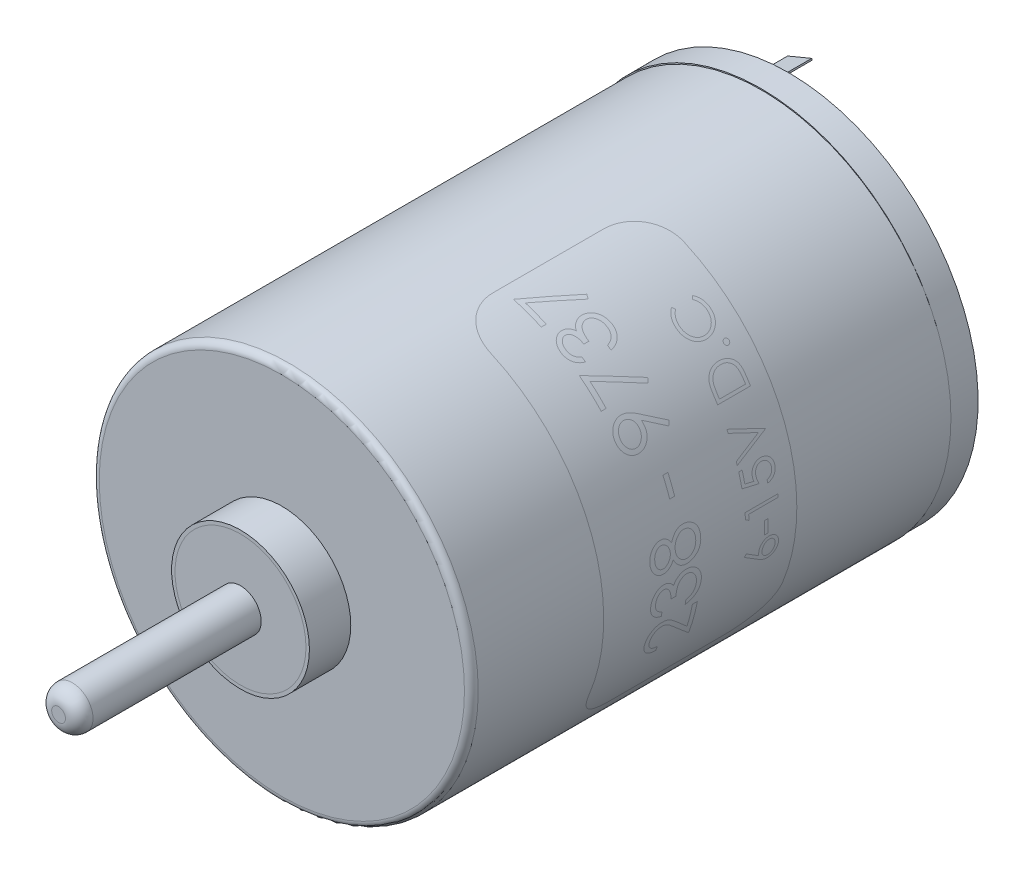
SolidWorks part; units mm, degrees
ref_plane "Front Plane" through (0, 0, 0) normal (0, 0, 1) x (1, 0, 0)
ref_plane "Top Plane" through (0, 0, 0) normal (0, 1, 0) x (1, 0, 0)
ref_plane "Right Plane" through (0, 0, 0) normal (1, 0, 0) x (0, 0, -1)
imported_body "Casing-1-solid1"
imported_body "Endplate-1-solid1"
imported_body "Endplate-1-solid2"
imported_body "Endplate-1-solid3"
imported_body "Rotorshaft-1-solid1"
imported_body "Bearing-1-solid1"
ref_plane "Plane1" through (7.7753, 3.2242, 0) normal (0.9237, 0.383, 0) x (0, 0, -1)
sketch "Sketch1" plane through (7.7753, 3.2242, 0) normal (0.9237, 0.383, 0) x (0, 0, -1)
  line L0 (-1.1844, 17.5157) -> (-1.1844, -8.0143) construction
  line L5 (4.4889, 17.5157) -> (4.4889, -7.7179) construction
  text T0 " 238 - 9737"
  text T1 "6-15V D.C" font "Century Gothic" height in points 9
wrap "Wrap1" sketch "Sketch1" wrap type scribe source sketch "Sketch1"
sketch "Sketch2" plane through (7.7753, 3.2242, 0) normal (0.9237, 0.383, 0) x (0, 0, -1)
  line L0 (-17.3244, -8.9015) -> (16.9756, -8.9015) construction
  line L1 (-5.2202, 18.291) -> (2.7921, 18.291)
  line L2 (-8.2202, 15.291) -> (-8.2202, -5.9015)
  line L3 (-5.2202, -8.9015) -> (2.7921, -8.9015)
  line L4 (5.7921, 15.291) -> (5.7921, -5.9015)
  arc A0 (-5.2202, 18.291) -> (-8.2202, 15.291) centre (-5.2202, 15.291) ccw
  arc A1 (2.7921, 18.291) -> (5.7921, 15.291) centre (2.7921, 15.291) cw
  arc A2 (5.7921, -5.9015) -> (2.7921, -8.9015) centre (2.7921, -5.9015) cw
  arc A3 (-5.2202, -8.9015) -> (-8.2202, -5.9015) centre (-5.2202, -5.9015) cw
  point P12 (5.7921, -8.9015)
  dimension "D1" = 3
wrap "Wrap2" sketch "Sketch2" wrap type scribe source sketch "Sketch2"
